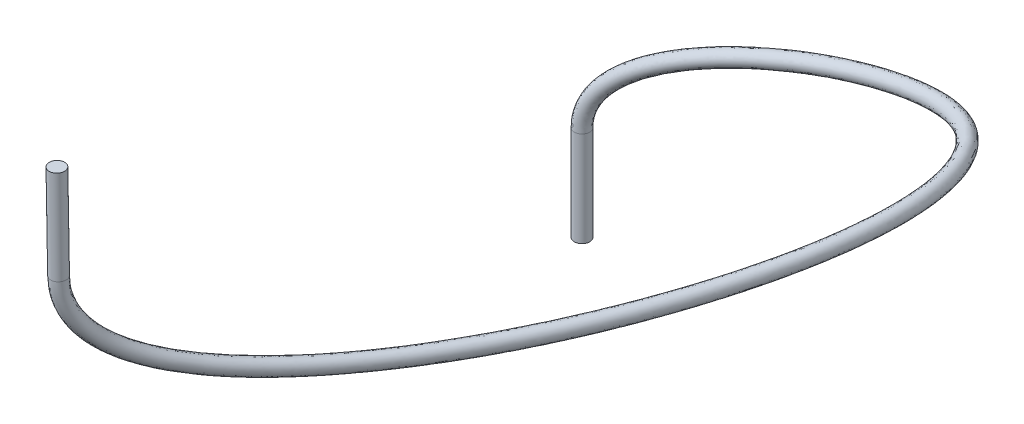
SolidWorks part; units mm, degrees
ref_plane "Front Plane" through (0, 0, 0) normal (0, 0, 1) x (1, 0, 0)
ref_plane "Top Plane" through (0, 0, 0) normal (0, 1, 0) x (1, 0, 0)
ref_plane "Right Plane" through (0, 0, 0) normal (1, 0, 0) x (0, 0, -1)
sketch3d "3DSketch1"
  line L0 (69.1868, 124.0594, 87.1142) -> (69.1868, 114.0533, 86.9395) construction
  line L1 (50.8, 71.5645, 13.3985) -> (50.8, 81.5721, 13.3985) construction
  line L2 (69.1868, 124.0594, 87.1142) -> (69.1868, 114.0533, 86.9395)
  line L3 (50.8, 71.5645, 13.3985) -> (50.8, 81.5721, 13.3985)
  spline S0 degree 3 poles (9067.8695, 4762.8166, -12287.4514) (-1289.4434, -180.0095, 1652.2688) (1249.118, 325.8724, -1067.6942) (-870.759, -85.6434, 710.1788) (14077.8105, -1601.4438, -7475.208) knots -2.792308 -2.792308 -2.792308 -2.792308 0.676518 3.122605 3.122605 3.122605 3.122605 only from (69.1868, 114.0533, 86.9395) to (50.8, 81.5721, 13.3985) construction
  spline S1 degree 3 poles (69.1868, 114.0533, 86.9395) (69.1868, 93.173, 86.575) (126.5688, 105.4805, -14.2934) (50.8, 91.5662, 13.3985) (50.8, 81.5721, 13.3985) knots 0 0 0 0 0.676518 1 1 1 1
ref_plane "Plane1" through (69.1868, 124.0594, 87.1142) normal (0, -0.9998, -0.0175) x (1, 0, 0)
sketch "PipeSketch" plane through (69.1868, 124.0594, 87.1142) normal (0, -0.9998, -0.0175) x (1, 0, 0)
  circle A0 centre (0, 0) radius 0.813
  dimension "OuterDiameter" = 1.626
sweep "Cable_1" add profiles "PipeSketch" path "3DSketch1"
